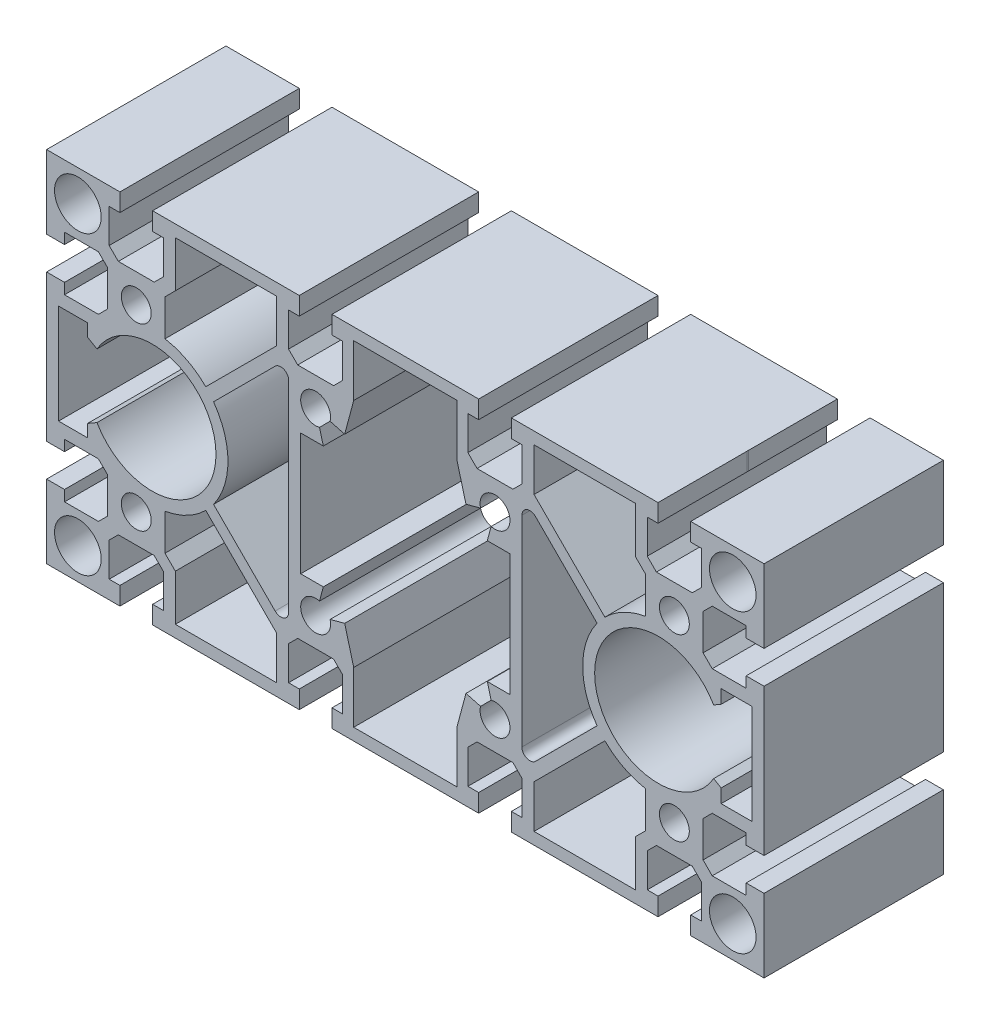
SolidWorks part; units mm, degrees
ref_plane "Front Plane" through (0, 0, 0) normal (0, 0, 1) x (1, 0, 0)
ref_plane "Top Plane" through (0, 0, 0) normal (0, 1, 0) x (1, 0, 0)
ref_plane "Right Plane" through (0, 0, 0) normal (1, 0, 0) x (0, 0, -1)
sketch "Sketch1" plane through (0, 0, 0) normal (0, 0, 1) x (1, 0, 0)
  line L7 (79.237, -9.0858) -> (77.3564, -8)
  line L8 (79.237, -12.5) -> (79.237, -9.0858)
  line L9 (87, -12.5) -> (79.237, -12.5)
  line L10 (87, 12.5) -> (87, -12.5)
  line L11 (79.237, 12.5) -> (87, 12.5)
  line L12 (79.237, 9.0858) -> (79.237, 12.5)
  line L13 (77.3564, 8) -> (79.237, 9.0858)
  line L21 (-79.7202, 9.3647) -> (-77.3564, 8)
  line L22 (-79.7202, 12.5) -> (-79.7202, 9.3647)
  line L23 (-87, 12.5) -> (-79.7202, 12.5)
  line L24 (-87, -12.5) -> (-87, 12.5)
  line L25 (-79.7202, -12.5) -> (-87, -12.5)
  line L26 (-79.7202, -9.3647) -> (-79.7202, -12.5)
  line L27 (-77.3564, -8) -> (-79.7202, -9.3647)
  line L34 (-32.3, 31.2) -> (-50.065, 13.435)
  line L35 (-32.3, 42) -> (-32.3, 31.2)
  line L36 (-57.7, 42) -> (-32.3, 42)
  line L37 (-57.7, 30.4574) -> (-57.7, 42)
  line L38 (-60.3, 27.8574) -> (-57.7, 30.4574)
  line L39 (-60.3, 18.7286) -> (-60.3, 27.8574)
  line L46 (-57.7, -30.4574) -> (-60.3, -27.8574)
  line L47 (-57.7, -42) -> (-57.7, -30.4574)
  line L48 (-32.3, -42) -> (-57.7, -42)
  line L49 (-32.3, -31.2) -> (-32.3, -42)
  line L50 (-50.065, -13.435) -> (-32.3, -31.2)
  line L51 (-60.3, -27.8574) -> (-60.3, -18.7286)
  line L58 (57.7, -42) -> (32.3, -42)
  line L59 (57.7, -30.4574) -> (57.7, -42)
  line L60 (60.3, -27.8574) -> (57.7, -30.4574)
  line L61 (60.3, -18.7286) -> (60.3, -27.8574)
  line L62 (32.3, -31.2) -> (50.065, -13.435)
  line L63 (32.3, -42) -> (32.3, -31.2)
  line L70 (50.065, 13.435) -> (32.3, 31.2)
  line L71 (60.3, 27.8574) -> (60.3, 18.7286)
  line L72 (57.7, 30.4574) -> (60.3, 27.8574)
  line L73 (57.7, 42) -> (57.7, 30.4574)
  line L74 (32.3, 42) -> (57.7, 42)
  line L75 (32.3, 31.2) -> (32.3, 42)
  line L79 (-32.6642, -26.5931) -> (-48.1122, -11.1452)
  line L80 (-29.25, 25.1789) -> (-29.25, -25.1789)
  line L81 (-48.1122, 11.1452) -> (-32.6642, 26.5931)
  line L85 (48.1122, -11.1452) -> (32.6642, -26.5931)
  line L86 (32.6642, 26.5931) -> (48.1122, 11.1452)
  line L87 (29.25, -25.1789) -> (29.25, 25.1789)
  line L112 (12.95, -29) -> (12.95, -42)
  line L113 (15.2147, -20.5479) -> (12.95, -29)
  line L114 (18.8778, -21.5294) -> (15.2147, -20.5479)
  line L115 (20.5708, -15.3) -> (21.5294, -18.8778)
  line L116 (26.25, -15.3) -> (20.5708, -15.3)
  line L117 (26.25, 15.3) -> (26.25, -15.3)
  line L118 (20.5708, 15.3) -> (26.25, 15.3)
  line L119 (21.5294, 18.8778) -> (20.5708, 15.3)
  line L120 (15.2147, 20.5479) -> (18.8778, 21.5294)
  line L121 (12.95, 29) -> (15.2147, 20.5479)
  line L122 (12.95, 42) -> (12.95, 29)
  line L123 (-12.95, 42) -> (12.95, 42)
  line L248 (85.5, -15.7) -> (85.5, -18.4)
  line L249 (85.5, -18.4) -> (90, -18.4)
  line L250 (90, -18.4) -> (90, 18.4)
  line L251 (90, 18.4) -> (85.5, 18.4)
  line L252 (85.5, 18.4) -> (85.5, 15.7)
  line L253 (85.5, 15.7) -> (77, 15.7)
  line L254 (77, 15.7) -> (74.7, 18)
  line L255 (74.7, 18) -> (74.7, 27)
  line L256 (74.7, 27) -> (77, 29.3)
  line L257 (77, 29.3) -> (85.5, 29.3)
  line L258 (85.5, 29.3) -> (85.5, 26.6)
  line L259 (85.5, 26.6) -> (90, 26.6)
  line L260 (90, 26.6) -> (90, 45)
  line L261 (90, 45) -> (71.6, 45)
  line L262 (71.6, 45) -> (71.6, 40.5)
  line L263 (71.6, 40.5) -> (74.3, 40.5)
  line L264 (74.3, 40.5) -> (74.3, 32)
  line L265 (74.3, 32) -> (72, 29.7)
  line L266 (72, 29.7) -> (63, 29.7)
  line L267 (63, 29.7) -> (60.7, 32)
  line L268 (60.7, 32) -> (60.7, 40.5)
  line L269 (60.7, 40.5) -> (63.4, 40.5)
  line L270 (63.4, 40.5) -> (63.4, 45)
  line L271 (63.4, 45) -> (26.6, 45)
  line L272 (26.6, 45) -> (26.6, 40.5)
  line L273 (26.6, 40.5) -> (29.3, 40.5)
  line L274 (29.3, 40.5) -> (29.3, 32)
  line L275 (29.3, 32) -> (27, 29.7)
  line L276 (27, 29.7) -> (18, 29.7)
  line L277 (18, 29.7) -> (15.7, 32)
  line L278 (15.7, 32) -> (15.7, 40.5)
  line L279 (15.7, 40.5) -> (18.4, 40.5)
  line L280 (18.4, 40.5) -> (18.4, 45)
  line L281 (18.4, 45) -> (-18.4, 45)
  line L282 (-18.4, 45) -> (-18.4, 40.5)
  line L283 (-18.4, 40.5) -> (-15.7, 40.5)
  line L284 (-15.7, 40.5) -> (-15.7, 32)
  line L285 (-15.7, 32) -> (-18, 29.7)
  line L286 (-18, 29.7) -> (-27, 29.7)
  line L287 (-27, 29.7) -> (-29.3, 32)
  line L288 (-29.3, 32) -> (-29.3, 40.5)
  line L289 (-29.3, 40.5) -> (-26.6, 40.5)
  line L290 (-26.6, 40.5) -> (-26.6, 45)
  line L291 (-26.6, 45) -> (-63.4, 45)
  line L292 (-63.4, 45) -> (-63.4, 40.5)
  line L293 (-63.4, 40.5) -> (-60.7, 40.5)
  line L294 (-60.7, 40.5) -> (-60.7, 32)
  line L295 (-60.7, 32) -> (-63, 29.7)
  line L296 (-63, 29.7) -> (-72, 29.7)
  line L297 (-72, 29.7) -> (-74.3, 32)
  line L298 (-74.3, 32) -> (-74.3, 40.5)
  line L299 (-74.3, 40.5) -> (-71.6, 40.5)
  line L300 (-71.6, 40.5) -> (-71.6, 45)
  line L301 (-71.6, 45) -> (-90, 45)
  line L302 (-90, 45) -> (-90, 26.6)
  line L303 (-90, 26.6) -> (-85.5, 26.6)
  line L304 (-85.5, 26.6) -> (-85.5, 29.3)
  line L305 (-85.5, 29.3) -> (-77, 29.3)
  line L306 (-77, 29.3) -> (-74.7, 27)
  line L307 (-74.7, 27) -> (-74.7, 18)
  line L308 (-74.7, 18) -> (-77, 15.7)
  line L309 (-77, 15.7) -> (-85.5, 15.7)
  line L310 (-85.5, 15.7) -> (-85.5, 18.4)
  line L311 (-85.5, 18.4) -> (-90, 18.4)
  line L312 (-90, 18.4) -> (-90, -18.4)
  line L313 (-90, -18.4) -> (-85.5, -18.4)
  line L314 (-85.5, -18.4) -> (-85.5, -15.7)
  line L315 (-85.5, -15.7) -> (-77, -15.7)
  line L316 (-77, -15.7) -> (-74.7, -18)
  line L317 (-74.7, -18) -> (-74.7, -27)
  line L318 (-74.7, -27) -> (-77, -29.3)
  line L319 (-77, -29.3) -> (-85.5, -29.3)
  line L320 (-85.5, -29.3) -> (-85.5, -26.6)
  line L321 (-85.5, -26.6) -> (-90, -26.6)
  line L322 (-90, -26.6) -> (-90, -45)
  line L323 (-90, -45) -> (-71.6, -45)
  line L324 (-71.6, -45) -> (-71.6, -40.5)
  line L325 (-71.6, -40.5) -> (-74.3, -40.5)
  line L326 (-74.3, -40.5) -> (-74.3, -32)
  line L327 (-74.3, -32) -> (-72, -29.7)
  line L328 (-72, -29.7) -> (-63, -29.7)
  line L329 (-63, -29.7) -> (-60.7, -32)
  line L330 (-60.7, -32) -> (-60.7, -40.5)
  line L331 (-60.7, -40.5) -> (-63.4, -40.5)
  line L332 (-63.4, -40.5) -> (-63.4, -45)
  line L333 (-63.4, -45) -> (-26.6, -45)
  line L334 (-26.6, -45) -> (-26.6, -40.5)
  line L335 (-26.6, -40.5) -> (-29.3, -40.5)
  line L336 (-29.3, -40.5) -> (-29.3, -32)
  line L337 (-29.3, -32) -> (-27, -29.7)
  line L338 (-27, -29.7) -> (-18, -29.7)
  line L339 (-18, -29.7) -> (-15.7, -32)
  line L340 (-15.7, -32) -> (-15.7, -40.5)
  line L341 (-15.7, -40.5) -> (-18.4, -40.5)
  line L342 (-18.4, -40.5) -> (-18.4, -45)
  line L343 (-18.4, -45) -> (18.4, -45)
  line L344 (18.4, -45) -> (18.4, -40.5)
  line L345 (18.4, -40.5) -> (15.7, -40.5)
  line L346 (15.7, -40.5) -> (15.7, -32)
  line L347 (15.7, -32) -> (18, -29.7)
  line L348 (18, -29.7) -> (27, -29.7)
  line L349 (27, -29.7) -> (29.3, -32)
  line L350 (29.3, -32) -> (29.3, -40.5)
  line L351 (29.3, -40.5) -> (26.6, -40.5)
  line L352 (26.6, -40.5) -> (26.6, -45)
  line L353 (26.6, -45) -> (63.4, -45)
  line L354 (63.4, -45) -> (63.4, -40.5)
  line L355 (63.4, -40.5) -> (60.7, -40.5)
  line L356 (60.7, -40.5) -> (60.7, -32)
  line L357 (60.7, -32) -> (63, -29.7)
  line L358 (63, -29.7) -> (72, -29.7)
  line L359 (72, -29.7) -> (74.3, -32)
  line L360 (74.3, -32) -> (74.3, -40.5)
  line L361 (74.3, -40.5) -> (71.6, -40.5)
  line L362 (71.6, -40.5) -> (71.6, -45)
  line L363 (71.6, -45) -> (90, -45)
  line L364 (90, -45) -> (90, -26.6)
  line L365 (90, -26.6) -> (85.5, -26.6)
  line L366 (85.5, -26.6) -> (85.5, -29.3)
  line L367 (85.5, -29.3) -> (77, -29.3)
  line L368 (77, -29.3) -> (74.7, -27)
  line L369 (74.7, -27) -> (74.7, -18)
  line L370 (74.7, -18) -> (77, -15.7)
  line L371 (77, -15.7) -> (85.5, -15.7)
  line L372 (-12.95, 29) -> (-12.95, 42)
  line L373 (-15.2147, 20.5479) -> (-12.95, 29)
  line L374 (-18.8778, 21.5294) -> (-15.2147, 20.5479)
  line L375 (-20.5708, 15.3) -> (-21.5294, 18.8778)
  line L376 (-26.25, 15.3) -> (-20.5708, 15.3)
  line L377 (-26.25, -15.3) -> (-26.25, 15.3)
  line L378 (-20.5708, -15.3) -> (-26.25, -15.3)
  line L379 (-21.5294, -18.8778) -> (-20.5708, -15.3)
  line L380 (-15.2147, -20.5479) -> (-18.8778, -21.5294)
  line L381 (-12.95, -29) -> (-15.2147, -20.5479)
  line L382 (-12.95, -42) -> (-12.95, -29)
  line L383 (12.95, -42) -> (-12.95, -42)
  circle A8 centre (82.15, -37.15) radius 5.85
  circle A9 centre (82.15, 37.15) radius 5.85
  circle A10 centre (67.5, 22.5) radius 3.75
  circle A11 centre (67.5, -22.5) radius 3.75
  circle A12 centre (-82.15, -37.15) radius 5.85
  circle A13 centre (-67.5, -22.5) radius 3.75
  circle A14 centre (-67.5, 22.5) radius 3.75
  circle A15 centre (-82.15, 37.15) radius 5.85
  arc A17 (77.3564, 8) -> (77.3564, -8) centre (63.5, 0) ccw
  arc A19 (-77.3564, -8) -> (-77.3564, 8) centre (-63.5, 0) ccw
  arc A21 (-50.065, 13.435) -> (-60.3, 18.7286) centre (-63.5, 0) ccw
  arc A23 (-60.3, -18.7286) -> (-50.065, -13.435) centre (-63.5, 0) ccw
  arc A25 (50.065, -13.435) -> (60.3, -18.7286) centre (63.5, 0) ccw
  arc A27 (60.3, 18.7286) -> (50.065, 13.435) centre (63.5, 0) ccw
  arc A31 (-32.6642, -26.5931) -> (-29.25, -25.1789) centre (-31.25, -25.1789) ccw
  arc A32 (-29.25, 25.1789) -> (-32.6642, 26.5931) centre (-31.25, 25.1789) ccw
  arc A33 (-48.1122, -11.1452) -> (-48.1122, 11.1452) centre (-63.5, 0) ccw
  arc A37 (29.25, -25.1789) -> (32.6642, -26.5931) centre (31.25, -25.1789) ccw
  arc A38 (48.1122, 11.1452) -> (48.1122, -11.1452) centre (63.5, 0) ccw
  arc A39 (32.6642, 26.5931) -> (29.25, 25.1789) centre (31.25, 25.1789) ccw
  arc A44 (18.8778, -21.5294) -> (21.5294, -18.8778) centre (22.5, -22.5) ccw
  arc A45 (21.5294, 18.8778) -> (18.8778, 21.5294) centre (22.5, 22.5) ccw
  arc A46 (-18.8778, 21.5294) -> (-21.5294, 18.8778) centre (-22.5, 22.5) ccw
  arc A47 (-21.5294, -18.8778) -> (-18.8778, -21.5294) centre (-22.5, -22.5) ccw
extrude "Extrude1" add sketch "Sketch1" along normal blind 45
sketch "Sketch2" plane through (0, 45, 0) normal (0, 1, 0) x (1, 0, 0)
  line L0 (-87, 0) -> (-79.7202, 0) construction
  line L1 (-90, -45) -> (-90, 0) construction
  line L2 (90, -45) -> (90, 0) construction
  line L3 (90, 0) -> (71.6, 0) construction
  point P0 (-67.4956, -22.5044)
  point P1 (67.4956, -22.5044)
  point P2 (-83.3601, 0)
  point P9 (80.8, 0)
  dimension "D1" = 22.5044
  dimension "D2" = 22.5044
  dimension "D3" = 22.5044
  dimension "D4" = 22.5044
hole_wizard "Ø15.0 (15) Diameter Hole1" positions "3DSketch1" profile "Sketch3" hole size "Ø15.0" standard "Ansi Metric"
sketch3d "3DSketch1"
  point P0 (-67.4956, 45, 22.5044)
  point P3 (67.4956, 45, 22.5044)
sketch "Sketch3" plane through (-67.4956, 45, 22.5044) normal (1, 0, 0) x (0, 0, 1)
  line L0 (0, 0) -> (0, 40.5635)
  line L1 (0, 40.5635) -> (4.1, 38.1)
  line L2 (4.1, 38.1) -> (4.1, 0)
  line L5 (4.1, 0) -> (0, 0)
  line L10 (0, 40.5635) -> (-4.1, 38.1) construction
  line L11 (0, -6.35) -> (0, 107.95) construction
  dimension "Hole Dia." = 8.2
  dimension "Hole Depth" = 38.1
  dimension "Drill Angle" = 118
